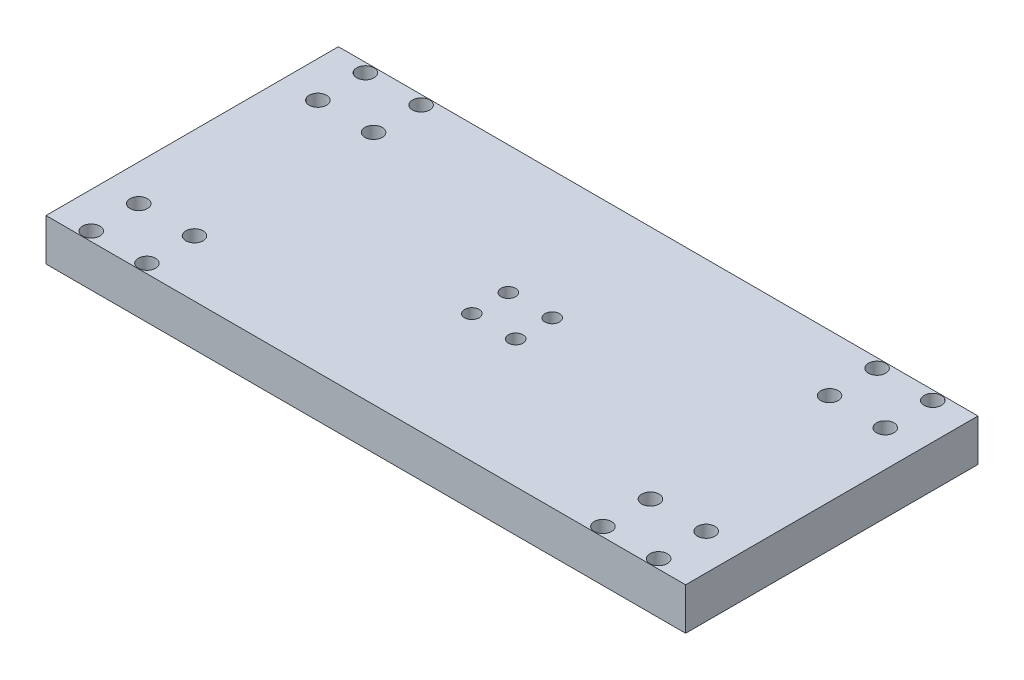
SolidWorks part; units mm, degrees
ref_plane "Alzado" through (0, 0, 0) normal (0, 0, 1) x (1, 0, 0)
ref_plane "Planta" through (0, 0, 0) normal (0, 1, 0) x (1, 0, 0)
ref_plane "Vista lateral" through (0, 0, 0) normal (1, 0, 0) x (0, 0, -1)
sketch "Croquis1" plane through (0, 0, 0) normal (0, 1, 0) x (1, 0, 0)
  line L0 (315, 124) -> (315, 36) construction
  line L1 (0, 0) -> (350, 0)
  line L2 (0, 0) -> (0, 160)
  line L3 (0, 160) -> (350, 160)
  line L4 (350, 0) -> (350, 160)
  line L5 (307, 124) -> (323, 124) construction
  line L6 (307, 36) -> (323, 36) construction
  line L7 (315, 80) -> (231.5014, 80) construction
  circle A0 centre (19.75, 155) radius 4.75
  circle A1 centre (50.25, 155) radius 4.75
  circle A2 centre (50.25, 129) radius 4.75
  circle A3 centre (19.75, 129) radius 4.75
  circle A4 centre (299.75, 155) radius 4.75
  circle A5 centre (330.25, 155) radius 4.75
  circle A6 centre (330.25, 129) radius 4.75
  circle A7 centre (299.75, 129) radius 4.75
  circle A8 centre (299.75, 31) radius 4.75
  circle A9 centre (330.25, 31) radius 4.75
  circle A10 centre (330.25, 5) radius 4.75
  circle A11 centre (299.75, 5) radius 4.75
  circle A12 centre (19.75, 31) radius 4.75
  circle A13 centre (50.25, 31) radius 4.75
  circle A14 centre (50.25, 5) radius 4.75
  circle A15 centre (19.75, 5) radius 4.75
  dimension "D3" = 9.5
  dimension "D1" = 350
  dimension "D2" = 160
extrude "Saliente-Extruir1" add sketch "Croquis1" along normal blind 23
sketch "Croquis2" plane through (0, 23, 0) normal (0, 1, 0) x (1, 0, 0)
  line L0 (175, 160) -> (175, 0) construction
  line L1 (350, 160) -> (0, 160) construction
  line L2 (0, 0) -> (350, 0) construction
  line L4 (163, 70) -> (187, 70) construction
  line L5 (163, 70) -> (163, 90) construction
  line L6 (163, 90) -> (187, 90) construction
  line L7 (187, 70) -> (187, 90) construction
  circle A0 centre (163, 90) radius 4
  circle A1 centre (187, 90) radius 4
  circle A2 centre (163, 70) radius 4
  circle A3 centre (187, 70) radius 4
  point P6 (175, 80)
  dimension "D5" = 8
  dimension "D1" = 24
  dimension "D2" = 20
  dimension "D3" = 12
  dimension "D4" = 10
extrude "Cortar-Extruir1" cut sketch "Croquis2" against normal blind 10
